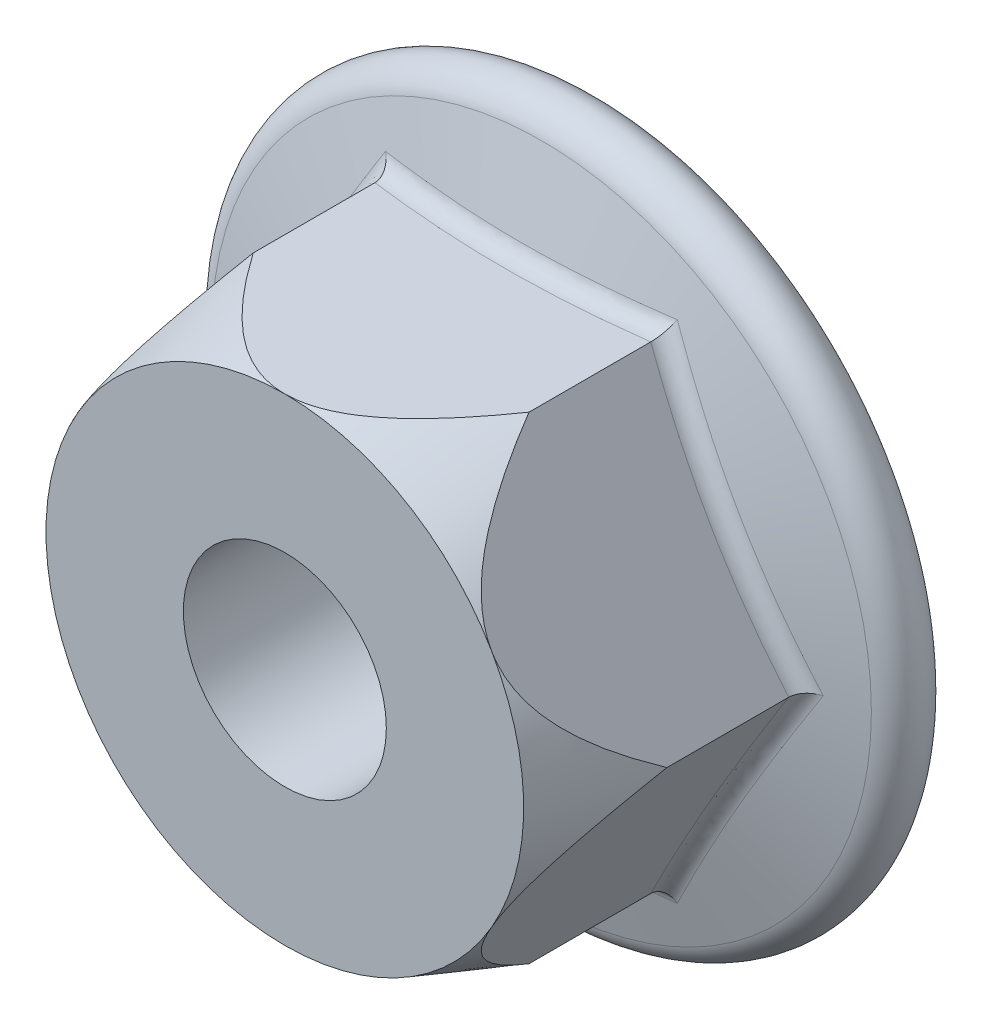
SolidWorks part; units mm, degrees
ref_plane "Front" through (0, 0, 0) normal (0, 0, 1) x (1, 0, 0)
ref_plane "Top" through (0, 0, 0) normal (0, 1, 0) x (1, 0, 0)
ref_plane "Right" through (0, 0, 0) normal (1, 0, 0) x (0, 0, -1)
other "Configuration Table"
sketch "Sketch1" plane through (0, 0, 0) normal (0, 0, 1) x (1, 0, 0)
  line L1 (4.6188, 0) -> (2.3094, 4)
  line L2 (2.3094, 4) -> (-2.3094, 4)
  line L3 (-2.3094, 4) -> (-4.6188, 0)
  line L4 (-4.6188, 0) -> (-2.3094, -4)
  line L5 (-2.3094, -4) -> (2.3094, -4)
  line L6 (2.3094, -4) -> (4.6188, 0)
  circle A0 centre (0, 0) radius 4 construction
extrude "BaseNut" add sketch "Sketch1" against normal blind 5.3
sketch "Sketch2" plane through (-0.4812, 0, -5.1) normal (0, 1, 0) x (0, 0, -1)
  line L0 (-0.1158, 4.1376) -> (0.2, 4.1376)
  line L2 (0.2, 4.1376) -> (0.2, 2.9588)
  line L4 (0.2, 2.9588) -> (-0.1158, 4.1376)
  line L5 (-3.32, 4.1376) -> (-5.1, 4.1376)
  line L6 (-5.1, 4.1376) -> (-5.1, 3.5188)
  line L8 (-5.1, 3.5188) -> (-3.32, 4.1376)
  line L9 (0, -0.4812) -> (-5.5811, -0.4812) construction
  line L10 (-5.1, 1.8282) -> (-5.1, 4.1376) construction
  line L11 (0.2, 4.1376) -> (-5.1, 4.1376) construction
  line L12 (0.2, 4.1376) -> (0.2, 1.8282) construction
revolve "Double-Chamfer" cut sketch "Sketch2" angle 360 about L9
sketch "Sketch3" plane through (0, 0, 0) normal (0, 0, 1) x (1, 0, 0)
  circle A0 centre (0, 0) radius 1.7
extrude "Hole" cut sketch "Sketch3" against normal through all
chamfer "EndChamfer" distance 0.4857 angle 45 1 edges at (1.7, 0, -5.3)
sketch "Sketch4" plane through (0.0678, 0, -5.8322) normal (0, 1, 0) x (0, 0, -1)
  line L0 (-0.5322, 3.5078) -> (-0.5322, 5.4592)
  line L1 (-1.365, 5.5908) -> (-1.5322, 5.5908) construction
  line L2 (-1.5322, 5.5908) -> (-1.7744, 4.6866)
  line L3 (-0.5322, 4.6866) -> (-0.5322, 3.5078) construction
  line L4 (-1.7744, 4.6866) -> (-1.7744, 3.5078) construction
  line L5 (-1.7744, 3.5078) -> (-0.5322, 3.5078)
  line L6 (-0.0801, 0.0678) -> (-7.1294, 0.0678) construction
  line L8 (-1.7744, 3.5078) -> (-2.0903, 3.5078)
  line L9 (-1.7744, 4.6866) -> (-2.0903, 3.5078)
  line L12 (-0.848, 4.6866) -> (-4.0522, 4.6866) construction
  arc A0 (-0.5322, 5.4592) -> (-1.5322, 5.5908) centre (-1.0408, 5.4592) ccw
  dimension "D1" = 11.8
  dimension "h1" = 1
  dimension "D2" = 15
revolve "Flange" add sketch "Sketch4" angle 360 about L6
fillet "FlangeFillet" radius 0.3 6 edges
sketch "Sketch5" plane through (0, 0, 0) normal (0, 1, 0) x (1, 0, 0)
  line L0 (0, 6.0366) -> (0, -0.8862) construction
  line L1 (1.4, 4.9643) -> (1.7, 4.9643)
  line L2 (1.7, 4.9643) -> (1.9598, 4.8143)
  line L3 (1.9598, 4.8143) -> (1.7, 4.6643)
  line L4 (1.7, 4.6643) -> (1.4, 4.6643)
  line L5 (1.4, 4.6643) -> (1.4, 4.9643)
  line L6 (1.7, 4.8143) -> (-1.7, 4.8143) construction
revolve "Cut-Revolve10" [suppressed] cut sketch "Sketch5" angle 360 about L0
pattern_linear "LPattern10" [suppressed] count 13 spacing 0.36
equation "\"e@Sketch2\" = \"s@Sketch1\""
equation "\"D1@EndChamfer\" = \"D1@Sketch3\" / 7"
equation "\"D2@Sketch5\" = \"D1@Sketch3\""
equation "\"D1@Sketch5\" = (  \"D2@ThreadCosmetic1\" - \"D1@Sketch3\" )  / 2"
equation "\"D3@LPattern10\" = \"D1@Sketch5\" * 1.2"
equation "\"D1@LPattern10\" =  ( \"h@BaseNut\"  - \"D1@EndChamfer\" ) / \"D3@LPattern10\" "
